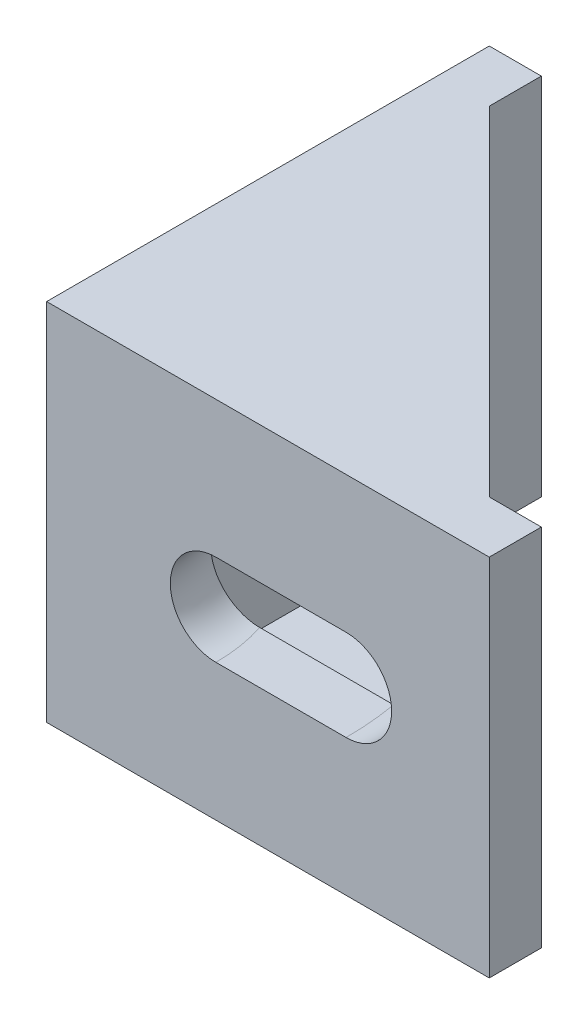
SolidWorks part; units mm, degrees
ref_plane "前视基准面" through (0, 0, 0) normal (0, 0, 1) x (1, 0, 0)
ref_plane "上视基准面" through (0, 0, 0) normal (0, 1, 0) x (1, 0, 0)
ref_plane "右视基准面" through (0, 0, 0) normal (1, 0, 0) x (0, 0, -1)
sketch "草图1" plane through (0, 0, 0) normal (0, 1, 0) x (1, 0, 0)
  line L0 (0, 59.8975) -> (0, 25.8975)
  line L1 (0, 25.8975) -> (34, 25.8975)
  line L2 (34, 25.8975) -> (0, 59.8975)
extrude "凸台-拉伸1" add sketch "草图1" along normal blind 28
ref_plane "基准面1" through (4, 0, 0) normal (-1, 0, 0) x (0, 0, 1)
sketch "草图2" plane through (4, 0, 0) normal (-1, 0, 0) x (0, 0, 1)
  line L0 (-59.8975, 26) -> (-29.8975, 26)
  line L1 (-59.8975, 28) -> (-59.8975, 0) construction
  line L2 (-29.8975, 26) -> (-29.8975, 2)
  line L3 (-29.8975, 2) -> (-59.8975, 2)
  line L4 (-59.8975, 2) -> (-59.8975, 26)
  line L5 (-25.8975, 28) -> (-25.8975, 0) construction
  line L6 (-25.8975, 28) -> (-59.8975, 28) construction
  line L7 (-25.8975, 0) -> (-59.8975, 0) construction
  dimension "D1" = 4
  dimension "D2" = 2
  dimension "D3" = 2
extrude "切除-拉伸1" cut sketch "草图2" against normal blind 28
sketch "草图3" plane through (0, 0, 0) normal (-1, 0, 0) x (0, 0, 1)
  line L0 (-38.8975, 14) -> (-48.8975, 14) construction
  line L1 (-38.8975, 10.5) -> (-48.8975, 10.5)
  line L2 (-38.8975, 17.5) -> (-48.8975, 17.5)
  line L3 (-25.8975, 28) -> (-25.8975, 0) construction
  arc A0 (-38.8975, 10.5) -> (-38.8975, 17.5) centre (-38.8975, 14) ccw
  arc A1 (-48.8975, 17.5) -> (-48.8975, 10.5) centre (-48.8975, 14) ccw
  point P2 (-43.8975, 14)
  point P9 (-25.8975, 14)
  dimension "D2" = 3.5
  dimension "D3" = 10
  dimension "D1" = 13
revolve "切除-旋转1" cut sketch "草图3" angle 360 about axis through (0, 28, -25.8975) along (0, -1, 0)
sketch "草图4" plane through (0, 0, 0) normal (0, -1, 0) x (1, 0, 0)
  line L0 (0, -59.8975) -> (4, -59.8975)
  line L1 (4, 15.4) -> (4, -15.4) construction
  line L2 (4, -59.8975) -> (4, -55.8975)
  line L3 (34, -25.8975) -> (0, -59.8975) construction
  line L4 (4, -55.8975) -> (0, -59.8975)
  line L5 (34, -25.8975) -> (34, -29.8975)
  line L6 (34, -29.8975) -> (30, -29.8975)
  line L7 (30, -29.8975) -> (34, -25.8975)
extrude "凸台-拉伸2" add sketch "草图4" against normal up to surface (28 mm away)
